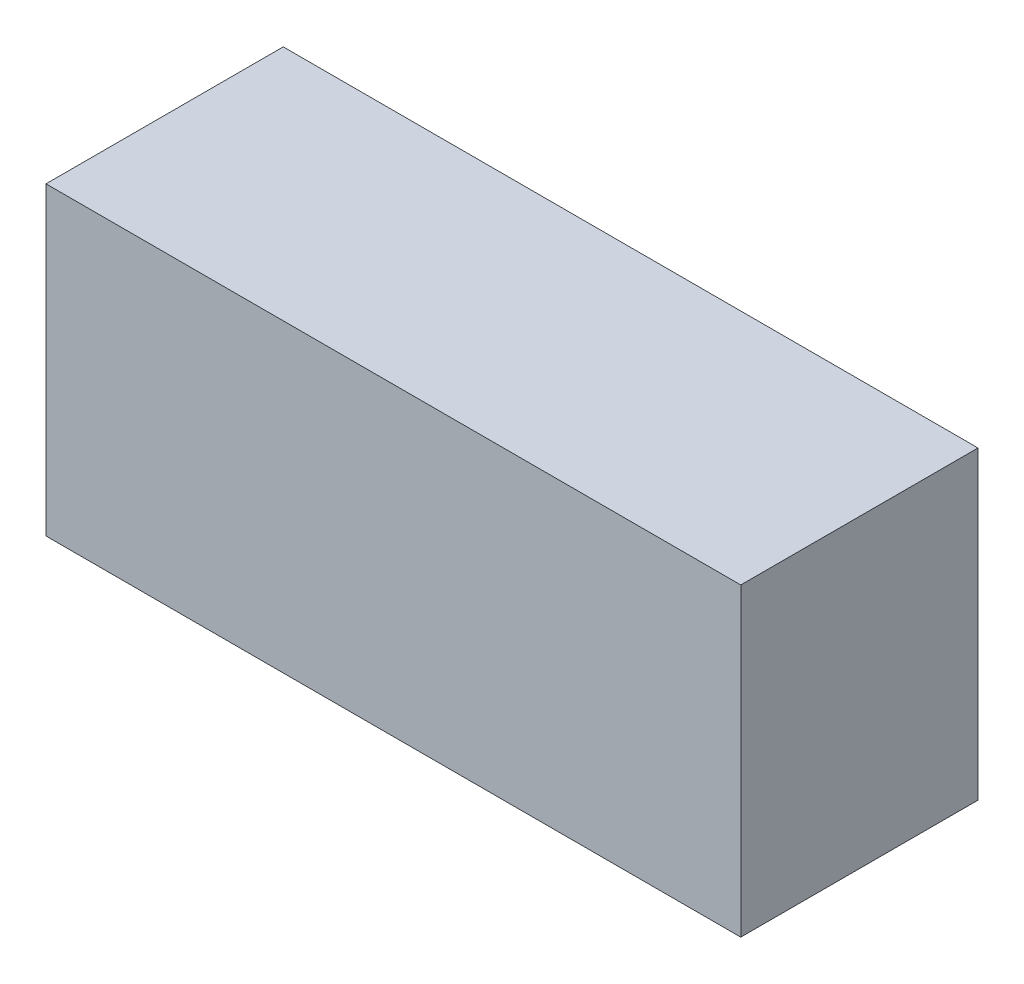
SolidWorks part; units mm, degrees
ref_plane "Face" through (0, 0, 0) normal (0, 0, 1) x (1, 0, 0)
ref_plane "Dessus" through (0, 0, 0) normal (0, 1, 0) x (1, 0, 0)
ref_plane "Droite" through (0, 0, 0) normal (1, 0, 0) x (0, 0, -1)
sketch "Esquisse1" plane through (0, 0, 0) normal (0, 0, 1) x (1, 0, 0)
  line L1 (0, 0) -> (20.5, 0)
  line L2 (0, 0) -> (0, 9)
  line L3 (0, 9) -> (20.5, 9)
  line L4 (20.5, 0) -> (20.5, 9)
  dimension "D1" = 20.5
  dimension "D2" = 9
extrude "Extrusion1" add sketch "Esquisse1" along normal blind 7
